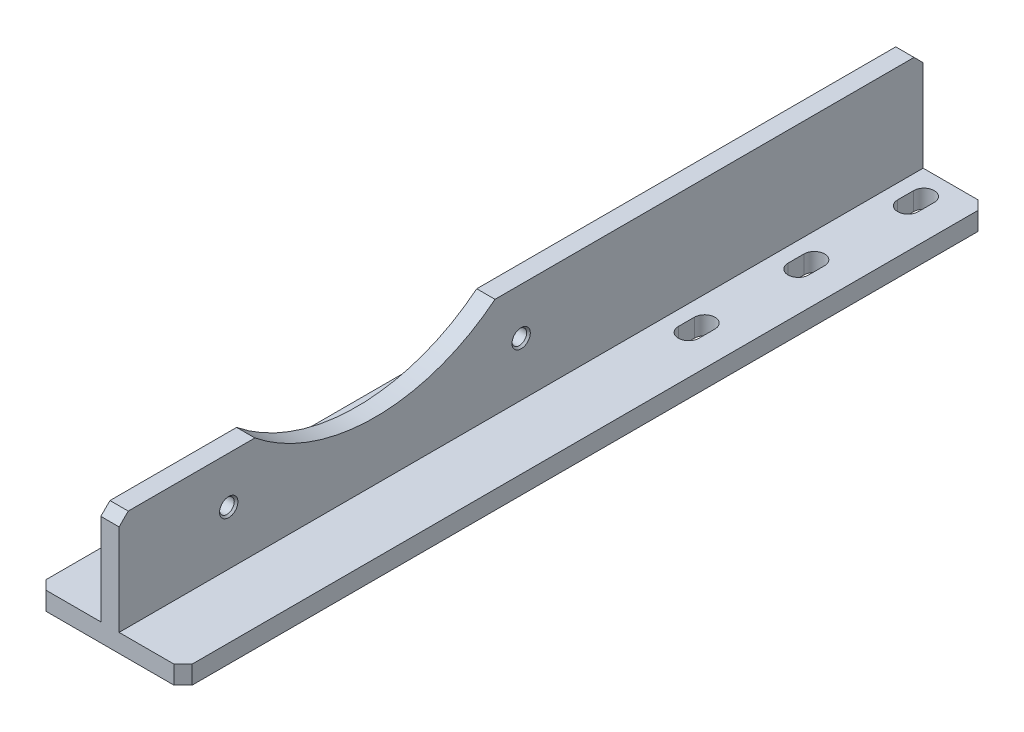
SolidWorks part; units mm, degrees
ref_plane "Front" through (0, 0, 0) normal (0, 0, 1) x (1, 0, 0)
ref_plane "Top" through (0, 0, 0) normal (0, 1, 0) x (1, 0, 0)
ref_plane "Right" through (0, 0, 0) normal (1, 0, 0) x (0, 0, -1)
sketch "Sketch1" plane through (0, 0, 0) normal (0, 0, 1) x (1, 0, 0)
  line L0 (0, 0) -> (0, -50.8) construction
  line L1 (-25.4, -50.8) -> (25.4, -50.8) construction
  line L2 (-3.175, 0) -> (-3.175, -47.625)
  line L3 (-25.4, -53.975) -> (25.4, -53.975)
  line L4 (3.175, 0) -> (3.175, -47.625)
  line L5 (-25.4, -47.625) -> (-3.175, -47.625)
  line L6 (25.4, -53.975) -> (25.4, -47.625)
  line L7 (-25.4, -47.625) -> (-25.4, -53.975)
  line L8 (3.175, -47.625) -> (25.4, -47.625)
  line L9 (-3.175, 0) -> (-3.175, -50.8) construction
  line L10 (3.175, 0) -> (3.175, -50.8) construction
  line L11 (-3.175, 0) -> (3.175, 0)
  line L12 (-25.4, -47.625) -> (25.4, -47.625) construction
  dimension "D1" = 50.8
  dimension "D2" = 25.4
  dimension "D3" = 50.8
  dimension "D4" = 3.175
  dimension "D5" = 3.175
extrude "Boss-Extrude1" add sketch "Sketch1" along normal mid plane 279.4
sketch "Sketch5" plane through (0, 0, 0) normal (0, 1, 0) x (1, 0, 0)
  line L4 (3.175, 139.7) -> (-3.175, 139.7)
  line L5 (-3.175, 139.7) -> (-3.175, -139.7)
  line L6 (-3.175, -139.7) -> (3.175, -139.7)
  line L7 (3.175, -139.7) -> (3.175, 139.7)
  line L8 (3.175, 139.7) -> (-3.175, 139.7)
  line L9 (-3.175, 139.7) -> (-3.175, -139.7)
  line L10 (-3.175, -139.7) -> (3.175, -139.7)
  line L11 (3.175, -139.7) -> (3.175, 139.7)
  dimension "D1" = 0
extrude "Cut-Extrude1" cut sketch "Sketch5" against normal blind 12.7
hole_wizard "1/4 Clearance Slot1" positions "Sketch2" profile "Sketch3" size "1/4" standard "ANSI Inch"
sketch "Sketch2" plane through (0, -47.625, 0) normal (0, 1, 0) x (1, 0, 0)
  line L0 (11.8364, 122.174) -> (11.8364, 134.874) construction
  line L1 (25.4, -139.7) -> (3.175, -139.7) construction
  line L2 (3.175, -139.7) -> (3.175, 139.7) construction
  point P0 (11.8364, 128.524)
  point P6 (11.8364, 90.424)
  point P9 (11.8364, 52.324)
  dimension "D1" = 12.7
  dimension "D2" = 192.024
  dimension "D3" = 38.1
  dimension "D4" = 76.2
  dimension "D5" = 8.6614
sketch "Sketch3" plane through (11.8364, -47.625, -128.524) normal (1, 0, 0) x (0, 0, 1)
  line L0 (0, 0) -> (0, 6.35)
  line L1 (0, 6.35) -> (3.5712, 6.35)
  line L2 (3.5712, 6.35) -> (3.5712, 0)
  line L5 (3.5712, 0) -> (0, 0)
  line L11 (0, -6.35) -> (0, 107.95) construction
  dimension "Thru Hole Dia." = 7.1425
  dimension "Thru Hole Depth" = 6.35
chamfer "Chamfer4" distance 3.175 angle 45 6 edges at (25.4, -50.8, 139.7) (-25.4, -50.8, 139.7) (-25.4, -50.8, -139.7) (25.4, -50.8, -139.7) (0, -12.7, 139.7) (0, -12.7, -139.7)
hole_wizard "1/4-20 Tapped Hole1" positions "Sketch6" profile "Sketch7" tap size "1/4-20" standard "ANSI Inch"
sketch "Sketch6" plane through (3.175, 0, 0) normal (1, 0, 0) x (0, 0, -1)
  point P0 (-101.6, -28.9389)
  point P3 (0, -28.9389)
sketch "Sketch7" plane through (3.175, -28.9389, 101.6) normal (0, 1, 0) x (0, 0, -1)
  line L0 (0, 0) -> (0, 6.35)
  line L1 (0, 6.35) -> (2.5527, 6.35)
  line L2 (2.5527, 6.35) -> (2.5527, 0.635)
  line L3 (2.5527, 0.635) -> (3.1877, 0)
  line L5 (3.1877, 0) -> (0, 0)
  line L6 (-2.5527, 0.635) -> (-3.1877, 0) construction
  line L11 (0, -6.35) -> (0, 107.95) construction
  dimension "Thru Tap Drill Dia." = 5.1054
  dimension "Thru Tap Drill Depth" = 6.35
  dimension "Near C'Sink Dia." = 6.3754
  dimension "Near C'Sink Angle" = 90
sketch "Sketch8" plane through (-3.175, 0, 0) normal (-1, 0, 0) x (0, 0, 1)
  line L0 (139.7, -15.875) -> (139.7, -47.625) construction
  circle A0 centre (50.8, 39.3109) radius 66.675
  dimension "D1" = 133.35
  dimension "D2" = 88.9
extrude "Cut-Extrude2" cut sketch "Sketch8" against normal through all
